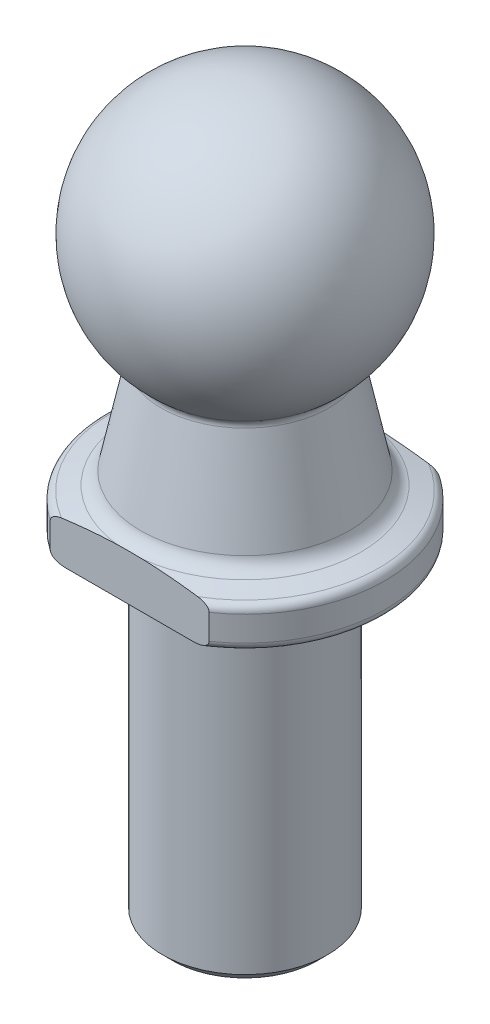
SolidWorks part; units mm, degrees
ref_plane "Plan de face" through (0, 0, 0) normal (0, 0, 1) x (1, 0, 0)
ref_plane "Plan de dessus" through (0, 0, 0) normal (0, 1, 0) x (1, 0, 0)
ref_plane "Plan de droite" through (0, 0, 0) normal (1, 0, 0) x (0, 0, -1)
sketch "Esquisse5" plane through (0, 0, 0) normal (0, 0, 1) x (1, 0, 0)
  line L0 (-14.4442, 8) -> (-14.4442, -36)
  line L1 (-14.4442, -36) -> (-18.8442, -36)
  line L2 (-19.4442, -35.4) -> (-19.4442, -16)
  line L3 (-14.4442, 8) -> (-14.4442, 17.8878) construction
  line L4 (-22.4442, -16) -> (-19.4442, -16)
  line L5 (-21.4825, -13.2083) -> (-22.5736, -13.5007)
  line L8 (-22.9442, -15.5) -> (-22.9442, -13.9837)
  line L10 (-20.7628, -12.4484) -> (-19.5341, -6.613)
  line L11 (-18.8442, -36) -> (-19.4442, -35.4)
  arc A0 (-19.6968, -6.1314) -> (-14.4442, 8) centre (-14.5591, 0.0008) cw
  arc A1 (-22.9442, -13.9837) -> (-22.5736, -13.5007) centre (-22.4442, -13.9837) cw
  arc A2 (-21.4825, -13.2083) -> (-20.7628, -12.4484) centre (-21.7413, -12.2424) ccw
  arc A3 (-19.6968, -6.1314) -> (-19.5341, -6.613) centre (-20.0234, -6.51) cw
  arc A5 (-22.4442, -16) -> (-22.9442, -15.5) centre (-22.4442, -15.5) cw
  point P6 (-19.4442, -36)
  point P17 (-22.9442, -13.6)
  point P22 (-19.4442, -6.245)
  point P28 (-22.9442, -16)
  dimension "D14" = 0.5
  dimension "D15" = 1
  dimension "D16" = 0.5
  dimension "D17" = 0.5
  dimension "D2" = 8
  dimension "D3" = 44
  dimension "D4" = 4.4
  dimension "D5" = 19.4
  dimension "D6" = 2.4
  dimension "D7" = 20
  dimension "D8" = 0.6
  dimension "D9" = 3
  dimension "D10" = 1.5163
  dimension "D11" = 1.1296
revolve "Révolution3" add sketch "Esquisse5" angle 360 about L3
sketch "Esquisse7" plane through (0, -16, 0) normal (0, -1, 0) x (1, 0, 0)
  line L1 (-20.9645, 17.0673) -> (2.1599, 17.0673)
  line L2 (-20.9645, 17.0673) -> (-20.9645, 7)
  line L3 (-20.9645, 7) -> (2.1599, 7)
  line L4 (2.1599, 17.0673) -> (2.1599, 7)
  line L5 (2.1599, -7) -> (-22.2513, -7)
  line L6 (2.1599, -7) -> (2.1599, -12.1093)
  line L7 (2.1599, -12.1093) -> (-22.2513, -12.1093)
  line L8 (-22.2513, -7) -> (-22.2513, -12.1093)
  circle A0 centre (-14.4442, 0) radius 4.4 construction
  dimension "D1" = 7
  dimension "D2" = 14
extrude "Enlèv. mat.-Extru.2" cut sketch "Esquisse7" against normal blind 5.5
